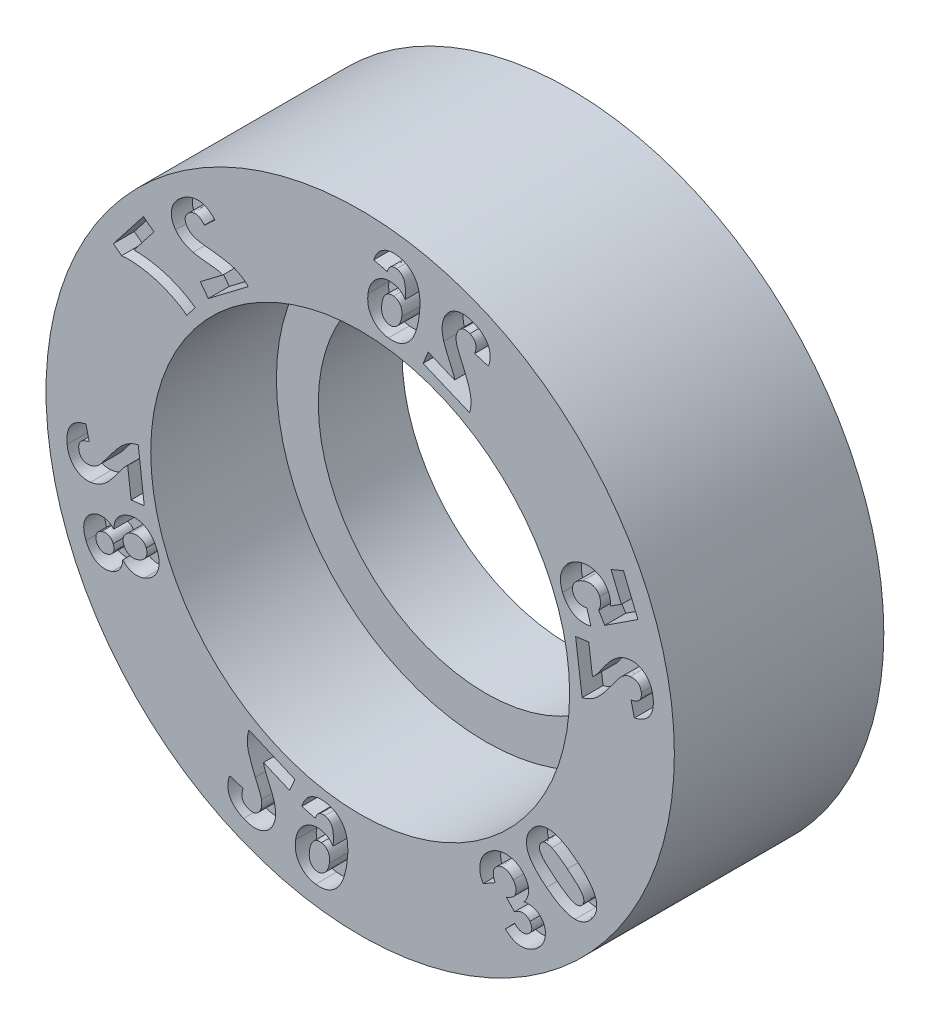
SolidWorks part; units mm, degrees
ref_plane "Front Plane" through (0, 0, 0) normal (0, 0, 1) x (1, 0, 0)
ref_plane "Top Plane" through (0, 0, 0) normal (0, 1, 0) x (1, 0, 0)
ref_plane "Right Plane" through (0, 0, 0) normal (1, 0, 0) x (0, 0, -1)
imported_body "Imported1"
other "DeleteFace2"
sketch "Sketch1" plane through (0, 0, 0) normal (0, 0, 1) x (1, 0, 0)
  line L0 (0, 0) -> (0, 8.7827) construction
  line L1 (0, 0) -> (7.606, 4.3913) construction
  line L2 (0, 0) -> (7.606, -4.3913) construction
  line L3 (0, 0) -> (0, -8.7827) construction
  line L4 (0, 0) -> (-7.606, -4.3913) construction
  line L5 (0, 0) -> (-7.606, 4.3913) construction
  circle A0 centre (0, 0) radius 5.3057 construction
  text T0 "25    26    27    28    29    30" font "Arial" height 1.8
  point P11 (0, 0)
  dimension "D1" = 6
extrude "Cut-Extrude1" cut sketch "Sketch1" against normal blind 0.5
